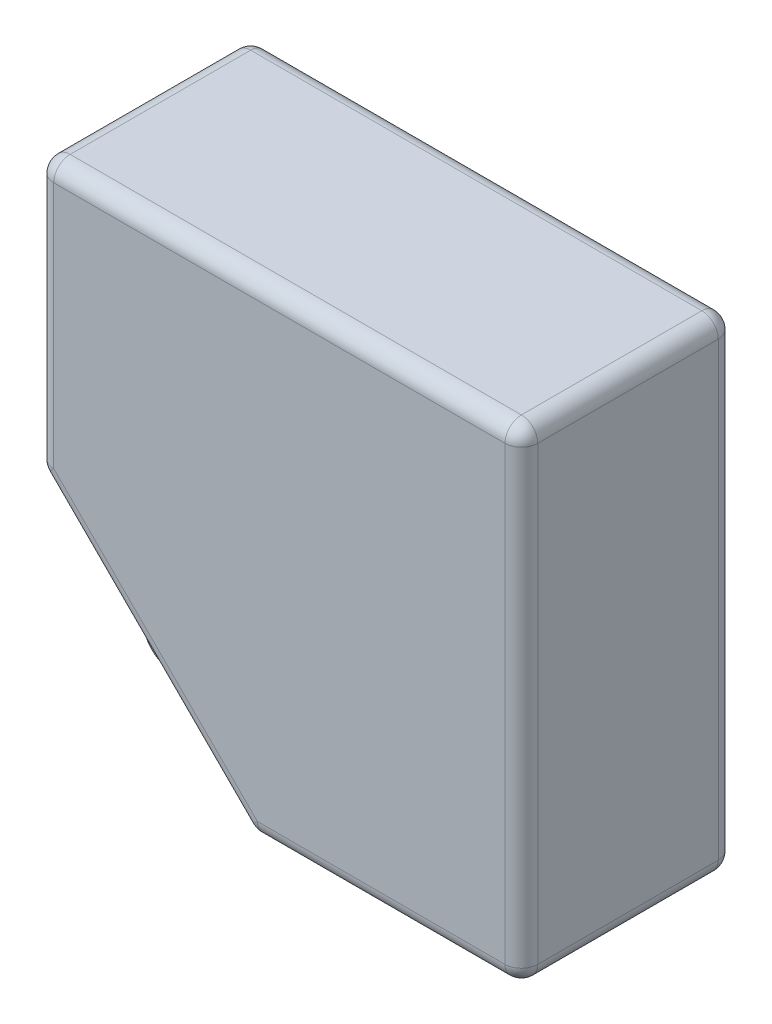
SolidWorks part; units mm, degrees
ref_plane "Ebene vorne" through (0, 0, 0) normal (0, 0, 1) x (1, 0, 0)
ref_plane "Ebene oben" through (0, 0, 0) normal (0, 1, 0) x (1, 0, 0)
ref_plane "Ebene rechts" through (0, 0, 0) normal (1, 0, 0) x (0, 0, -1)
sketch "Skizze1" plane through (0, 0, 0) normal (0, 0, 1) x (1, 0, 0)
  line L0 (-51.3737, 26.4208) -> (7.6263, 26.4208)
  line L1 (7.6263, -32.5792) -> (-51.3737, -32.5792)
  line L2 (-51.3737, -32.5792) -> (-51.3737, 26.4208)
  line L3 (7.6263, 26.4208) -> (7.6263, -32.5792)
  dimension "D1" = 59
  dimension "D2" = 59
extrude "Linear austragen1" add sketch "Skizze1" along normal blind 26
chamfer "Fase1" distance 26 angle 45 1 edges at (-51.3737, -32.5792, 13)
fillet "Verrundung1" radius 2 15 edges at (-21.8737, 26.4208, 26) (-51.3737, 26.4208, 13) (-51.3737, 9.9208, 26) (-51.3737, -6.5792, 13) (-38.3737, -19.5792, 26) (-25.3737, -32.5792, 13) (-8.8737, -32.5792, 26) (7.6263, -32.5792, 13) (7.6263, -3.0792, 26) (7.6263, 26.4208, 13) (7.6263, -3.0792, 0) (-21.8737, 26.4208, 0) (-51.3737, 9.9208, 0) (-38.3737, -19.5792, 0) (-8.8737, -32.5792, 0)
sketch "Skizze2" plane through (-28.9765, -28.9765, 0) normal (-0.7071, -0.7071, 0) x (0, 0, 1)
  line L0 (26, 30.8461) -> (26, -4.2666) construction
  line L1 (24, 30.8461) -> (2, 30.8461) construction
  circle A0 centre (13.0014, 13.0961) radius 5.1
  point P2 (26, 13.2897)
  dimension "D1" = 10.2
  dimension "D2" = 13
  dimension "D3" = 17.75
extrude "Linear austragen2" add sketch "Skizze2" along normal blind 10
